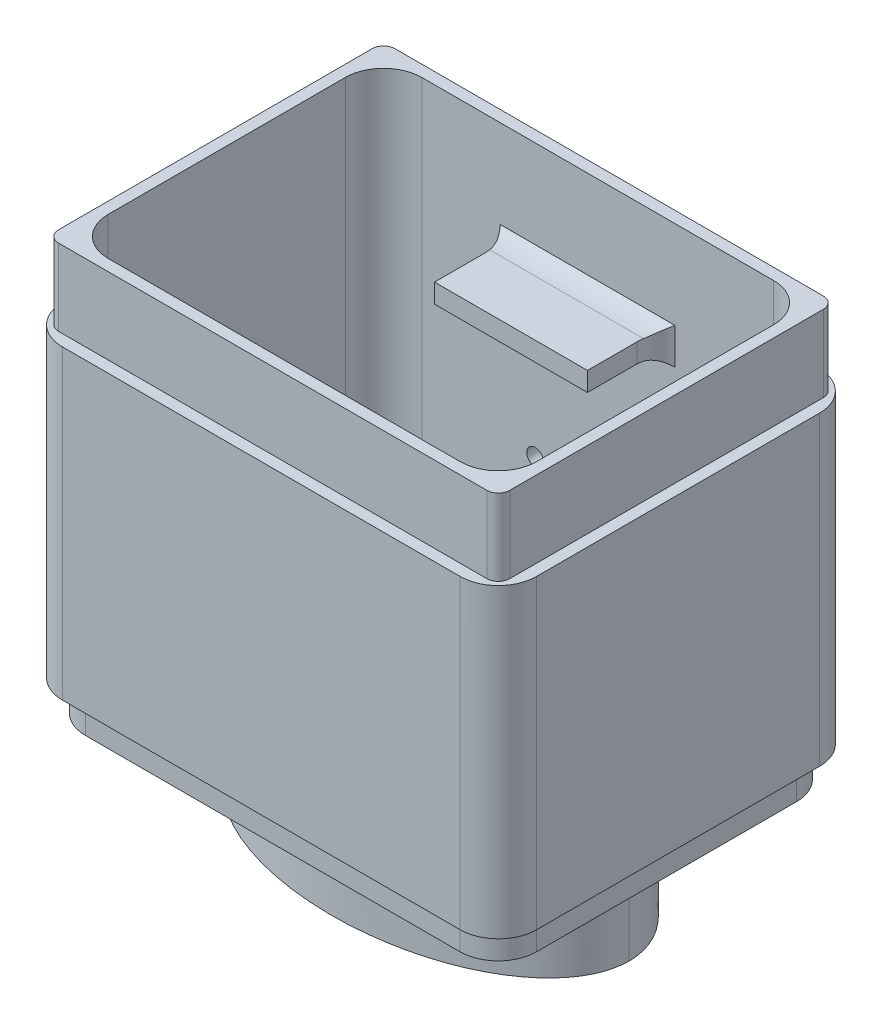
SolidWorks part; units mm, degrees
ref_plane "Front Plane" through (0, 0, 0) normal (0, 0, 1) x (1, 0, 0)
ref_plane "Top Plane" through (0, 0, 0) normal (0, 1, 0) x (1, 0, 0)
ref_plane "Right Plane" through (0, 0, 0) normal (1, 0, 0) x (0, 0, -1)
imported_body "Imported1"
imported_body "Imported2"
imported_body "Imported3"
imported_body "Imported4"
imported_body "Imported5"
fillet "Fillet1" radius 10
fillet "Fillet2" radius 10 3 edges
ref_plane "Plane1" through (0, 0, 0) normal (0, 0, -1) x (-1, 0, 0)
fillet "Fillet3" radius 10 4 edges
sketch "Sketch6" plane through (0, 100, 0) normal (0, 1, 0) x (1, 0, 0)
  line L0 (-56, 41) -> (56, 41)
  line L1 (-59, 44) -> (59, 44)
  line L2 (-59, 44) -> (-59, -44)
  line L3 (-59, -44) -> (59, -44)
  line L4 (59, 44) -> (59, -44)
  line L9 (56, 41) -> (56, -41)
  line L10 (-56, -41) -> (56, -41)
  line L11 (-56, 41) -> (-56, -41)
  dimension "D1" = 3
extrude "Boss-Extrude11" add sketch "Sketch6" against normal up to surface (88 mm away)
fillet "Fillet4" radius 3 4 edges at (-59, 90, 44) (59, 90, 44) (59, 90, -44) (-59, 90, -44)
fillet "Fillet5" radius 10 4 edges at (56, 56, 41) (56, 56, -41) (-56, 56, -41) (-56, 56, 41)
sketch "Sketch9" plane through (0, 0, -47) normal (0, 0, -1) x (-1, 0, 0)
  line L1 (-39.1043, 24.4281) -> (36.4156, 24.4281)
  line L2 (-39.1043, 24.4281) -> (-39.1043, 13.4281)
  line L3 (-39.1043, 13.4281) -> (36.4156, 13.4281)
  line L4 (36.4156, 24.4281) -> (36.4156, 13.4281)
extrude "Boss-Extrude12" add sketch "Sketch9" against normal up to surface (6 mm away)
sketch "Sketch10" plane through (0, 0, -47) normal (0, 0, -1) x (-1, 0, 0)
  line L2 (16.8472, 24.4281) -> (20.8903, 24.4281)
  line L3 (16.8472, 24.4281) -> (20.8903, 24.4281)
  spline S7 degree 3 poles (-44.0617, 4023.6066) (55.1854, -17.8059) (35.9045, 25.6684) (17.7417, 24.5421) (-2.8909, 22.3123) (-17.4407, -28.3348) (952.6337, -3863.9404) knots -4.369716 -4.369716 -4.369716 -4.369716 0.85934 0.912599 0.963653 6.943244 6.943244 6.943244 6.943244 only from (18.8446, 24.5819) to (16.8472, 24.4281)
  spline S8 degree 3 poles (-865.1517, -3875.5638) (56.1316, -27.9592) (41.0359, 22.3119) (19.9757, 24.5421) (1.3297, 25.6683) (-18.3922, -17.8489) (76.8037, 4023.7372) knots -5.227916 -5.227916 -5.227916 -5.227916 0.837406 0.88923 0.943468 6.279422 6.279422 6.279422 6.279422 only from (20.8903, 24.4281) to (18.8446, 24.5819)
  spline S9 degree 3 poles (18.8446, 24.5819) (18.6558, 24.5799) (18.2854, 24.5758) (17.7417, 24.5421) (17.2647, 24.4905) (16.9695, 24.4483) (16.8472, 24.4281) knots 0.803992 0.803992 0.803992 0.803992 0.85934 0.912599 0.963653 1 1 1 1
  spline S10 degree 3 poles (20.8903, 24.4281) (20.7653, 24.4483) (20.4636, 24.4905) (19.9757, 24.5421) (19.4186, 24.5758) (19.0386, 24.5799) (18.8446, 24.5819) knots 0.800487 0.800487 0.800487 0.800487 0.837406 0.88923 0.943468 1 1 1 1
  dimension "D1" = 0
extrude "Boss-Extrude13" add sketch "Sketch10" against normal up to surface (6 mm away)
sketch "Sketch11" plane through (0, 0, -47) normal (0, 0, -1) x (-1, 0, 0)
  line L1 (-26.6775, 17.153) -> (26.2898, 17.153)
  line L2 (-26.6775, 17.153) -> (-26.6775, 10.6547)
  line L3 (-26.6775, 10.6547) -> (26.2898, 10.6547)
  line L4 (26.2898, 17.153) -> (26.2898, 10.6547)
extrude "Boss-Extrude14" add sketch "Sketch11" against normal up to surface (6 mm away)
ref_plane "Plane2" through (0, 0, 0) normal (0, 0, -1) x (-1, 0, 0)
sketch "Sketch12" plane through (0, 0, 0) normal (0, 0, -1) x (-1, 0, 0)
  line L5 (12.662, 30.8) -> (-2.438, 30.8)
  line L6 (12.662, 30.8) -> (12.662, 17.2)
  line L8 (-2.438, 30.8) -> (-2.438, 17.2)
  line L9 (13.062, 30.3) -> (5.682, 30.3) construction
  line L11 (12.662, 17.2) -> (-2.438, 17.2)
  line L12 (-2.838, 17.7) -> (2.022, 17.7) construction
  line L13 (-2.938, 30.2) -> (-2.938, 17.8) construction
  line L14 (13.162, 21.9) -> (13.162, 23.5) construction
  circle A1 centre (16.362, 28.8279) radius 2.2
  arc A2 (14.662, 27.6822) -> (14.662, 29.9735) centre (16.362, 28.8279) ccw construction
  dimension "D5" = 0.15
  dimension "D1" = 0.5
  dimension "D2" = 0.5
  dimension "D3" = 0.5
  dimension "D4" = 0.5
extrude "Cut-Extrude2" cut sketch "Sketch12" along normal through all
